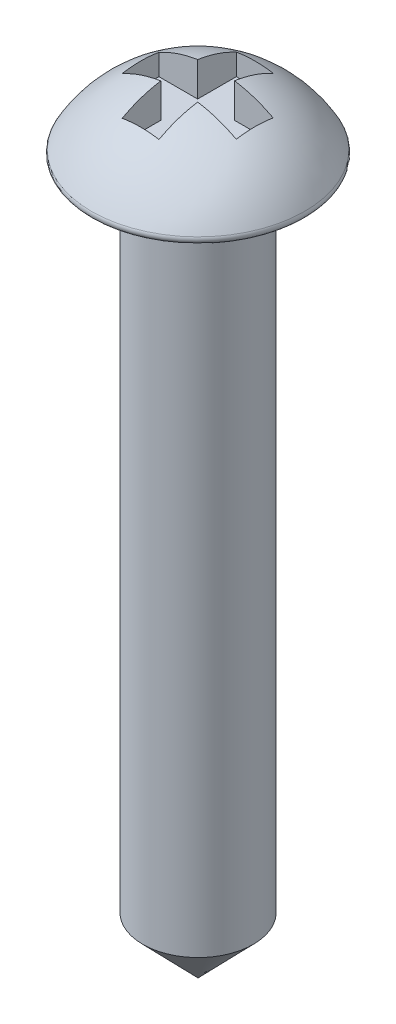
SolidWorks part; units mm, degrees
ref_plane "Plan de face" through (0, 0, 0) normal (0, 0, 1) x (1, 0, 0)
ref_plane "Plan de dessus" through (0, 0, 0) normal (0, 1, 0) x (1, 0, 0)
ref_plane "Plan de droite" through (0, 0, 0) normal (1, 0, 0) x (0, 0, -1)
sketch "Esquisse1" plane through (0, 0, 0) normal (0, 0, 1) x (1, 0, 0)
  line L0 (0, 3.8001) -> (0, -14.1293) construction
  line L1 (2.2, 0) -> (1.1, 0)
  line L2 (1.1, 0) -> (1.1, -13)
  line L3 (1.1, -13) -> (0, -14.1293)
  line L4 (0, -14.1293) -> (0, 1.393)
  arc A0 (2.2, 0) -> (0, 1.393) centre (0, -1.0408) ccw
  dimension "D1" = 1.1
  dimension "D2" = 13
  dimension "D3" = 2.2
revolve "Révolution1" add sketch "Esquisse1" angle 360 about L0
fillet "Congé1" radius 0.1 1 edges at (0, 0, 2.2)
ref_plane "Plan1" through (0, 1.1565, 0) normal (0, 1, 0) x (-1, 0, 0)
sketch "Esquisse2" plane through (0, 1.1565, 0) normal (0, 1, 0) x (-1, 0, 0)
  line L0 (0.0048, 1.1408) -> (0.0048, 0.0036) construction
  line L1 (-0.3619, 1.1408) -> (0.3716, 1.1408)
  line L2 (-0.3619, 1.1408) -> (-0.3619, 0.3704)
  line L3 (-0.3619, -1.1335) -> (0.3716, -1.1335)
  line L4 (0.3716, 1.1408) -> (0.3716, 0.3704)
  line L5 (-1.1323, 0.3704) -> (-0.3619, 0.3704)
  line L6 (-1.1323, 0.3704) -> (-1.1323, -0.3632)
  line L7 (-1.1323, -0.3632) -> (-0.3619, -0.3632)
  line L8 (1.142, 0.3704) -> (1.142, -0.3632)
  line L9 (0.0048, 0.0036) -> (0.0048, -1.1335) construction
  line L10 (1.142, 0.0036) -> (0.0048, 0.0036) construction
  line L11 (0.0048, 0.0036) -> (-1.1323, 0.0036) construction
  line L12 (0.3716, -0.3632) -> (1.142, -0.3632)
  line L13 (-0.3619, -0.3632) -> (-0.3619, -1.1335)
  line L14 (0.3716, 0.3704) -> (1.142, 0.3704)
  line L15 (0.3716, -0.3632) -> (0.3716, -1.1335)
extrude "Enlèv. mat.-Extru.1" cut sketch "Esquisse2" against normal mid plane 1
